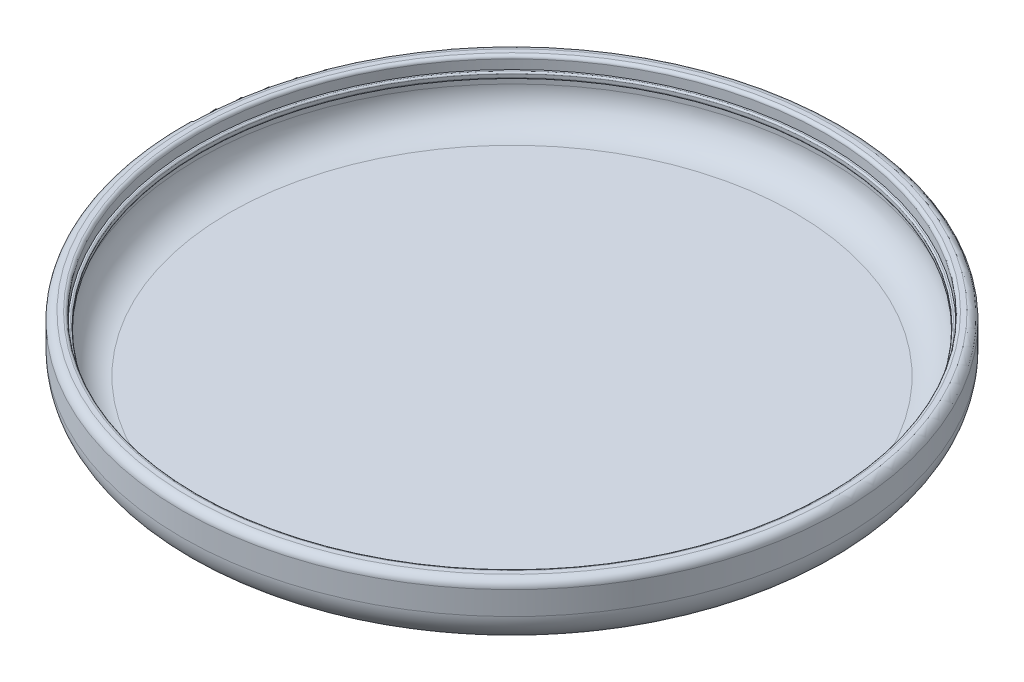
SolidWorks part; units mm, degrees
ref_plane "Front Plane" through (0, 0, 0) normal (0, 0, 1) x (1, 0, 0)
ref_plane "Top Plane" through (0, 0, 0) normal (0, 1, 0) x (1, 0, 0)
ref_plane "Right Plane" through (0, 0, 0) normal (1, 0, 0) x (0, 0, -1)
sketch "Sketch1" plane through (0, 0, 0) normal (1, 0, 0) x (0, 0, -1)
  line L0 (0, 0) -> (0, 28.7917) construction
  line L1 (52.578, 10.16) -> (51.816, 10.16)
  line L2 (0, 0) -> (48.768, 0)
  line L3 (0, 1.016) -> (0, 0)
  line L4 (0, 1.016) -> (46.228, 1.016)
  line L5 (51.308, 9.652) -> (51.308, 8.128)
  line L7 (53.848, 5.08) -> (53.848, 8.89)
  line L8 (51.308, 7.112) -> (51.308, 6.096)
  line L9 (51.308, 8.128) -> (51.054, 8.128)
  line L11 (51.308, 7.112) -> (51.054, 7.112)
  line L12 (50.8, 7.874) -> (50.8, 7.366)
  arc A0 (51.308, 6.096) -> (46.228, 1.016) centre (46.228, 6.096) cw
  arc A1 (48.768, 0) -> (53.848, 5.08) centre (48.768, 5.08) ccw
  arc A2 (51.816, 10.16) -> (51.308, 9.652) centre (51.816, 9.652) ccw
  arc A3 (53.848, 8.89) -> (52.578, 10.16) centre (52.578, 8.89) ccw
  arc A4 (51.054, 7.112) -> (50.8, 7.366) centre (51.054, 7.366) cw
  arc A5 (51.054, 8.128) -> (50.8, 7.874) centre (51.054, 7.874) ccw
  point P13 (53.848, 0)
  point P16 (51.308, 10.16)
  point P19 (53.848, 10.16)
  point P26 (50.8, 7.112)
  point P29 (50.8, 8.128)
  dimension "D6" = 5.08
  dimension "D7" = 0.508
  dimension "D8" = 1.27
  dimension "D12" = 0.254
  dimension "D1" = 2.54
  dimension "D3" = 53.848
  dimension "D4" = 1.016
  dimension "D5" = 10.16
  dimension "D9" = 1.016
  dimension "D10" = 0.508
  dimension "D11" = 2.032
revolve "Revolve1" add sketch "Sketch1" angle 360 about L0
